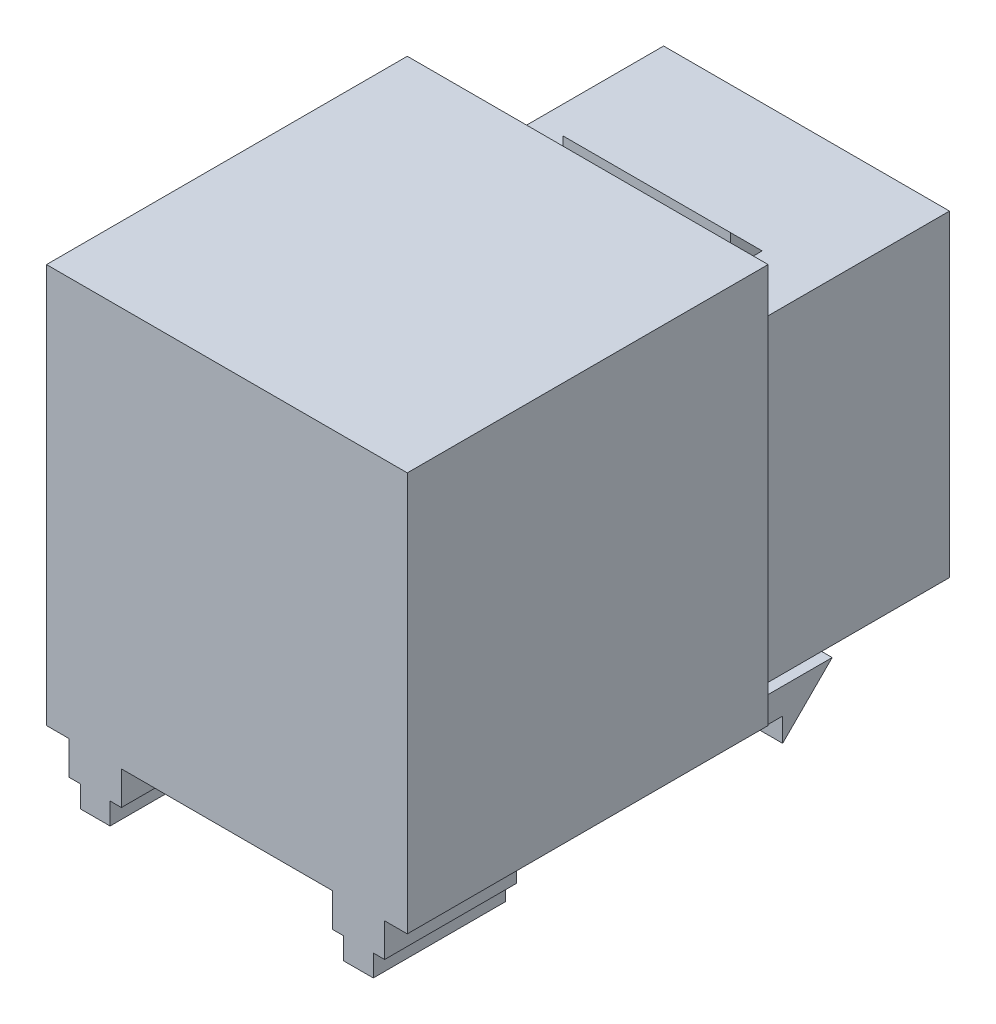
SolidWorks part; units mm, degrees
ref_plane "Front Plane" through (0, 0, 0) normal (0, 0, 1) x (1, 0, 0)
ref_plane "Top Plane" through (0, 0, 0) normal (0, 1, 0) x (1, 0, 0)
ref_plane "Right Plane" through (0, 0, 0) normal (1, 0, 0) x (0, 0, -1)
sketch "Skizze1" plane through (0, 0, 0) normal (0, 0, 1) x (1, 0, 0)
  line L1 (-7.25, -8.05) -> (7.25, -8.05)
  line L2 (-7.25, -8.05) -> (-7.25, 8.05)
  line L3 (-7.25, 8.05) -> (7.25, 8.05)
  line L4 (7.25, -8.05) -> (7.25, 8.05)
  line L5 (-7.25, -8.05) -> (7.25, 8.05) construction
  line L6 (-7.25, 8.05) -> (7.25, -8.05) construction
  point P0 (0, 0)
  dimension "D1" = 14.5
  dimension "D2" = 16.1
extrude "Aufsatz-Linear austragen1" add sketch "Skizze1" along normal blind 11.1
sketch "Skizze2" plane through (0, 0, 11.1) normal (0, 0, 1) x (1, 0, 0)
  line L0 (0, -8.05) -> (0, 11.0554) construction
  line L1 (-7.25, -8.05) -> (7.25, -8.05) construction
  line L2 (-9.15, -8.05) -> (9.15, -8.05)
  line L3 (9.15, -8.05) -> (9.15, 12.2)
  line L4 (9.15, 12.2) -> (-9.15, 12.2)
  line L5 (-9.15, -8.05) -> (-9.15, 12.2)
  point P10 (0, 12.2)
  dimension "D1" = 18.3
  dimension "D2" = 20.25
extrude "Aufsatz-Linear austragen2" add sketch "Skizze2" along normal blind 18.3
ref_plane "Ebene1" through (0, 0, 0) normal (-1, 0, 0) x (0, 0, 1)
sketch "Skizze3" plane through (0, 0, 0) normal (-1, 0, 0) x (0, 0, 1)
  line L0 (8.1, 8.05) -> (8.1, 9.65)
  line L1 (11.1, 8.05) -> (0, 8.05) construction
  line L2 (8.1, 9.65) -> (6.5, 8.05)
  line L3 (6.5, 8.05) -> (8.1, 8.05)
  line L5 (0, 8.05) -> (0, -8.05) construction
  dimension "D1" = 6.5
  dimension "D2" = 45
  dimension "D3" = 1.6
extrude "Aufsatz-Linear austragen3" add sketch "Skizze3" along normal mid plane 8.5
sketch "Skizze4" plane through (0, 0, 0) normal (-1, 0, 0) x (0, 0, 1)
  line L0 (16.8, -8.05) -> (16.8, -11.15)
  line L1 (29.4, -8.05) -> (11.1, -8.05) construction
  line L2 (14.8, -8.05) -> (14.8, -9.8364)
  line L3 (14.8, -9.8364) -> (4.7, -9.8364)
  line L4 (4.7, -9.8364) -> (7.2136, -12.35)
  line L5 (7.2136, -12.35) -> (7.2136, -11.15)
  line L6 (7.2136, -11.15) -> (16.8, -11.15)
  line L7 (0, 8.05) -> (0, -8.05) construction
  line L8 (11.1, -8.05) -> (0, -8.05) construction
  line L9 (14.8, -8.05) -> (16.8, -8.05)
  dimension "D1" = 4.7
  dimension "D2" = 2
  dimension "D3" = 3.1
  dimension "D4" = 12.1
  dimension "D6" = 45
  dimension "D7" = 4.3
extrude "Aufsatz-Linear austragen4" add sketch "Skizze4" along normal mid plane 12
ref_plane "Ebene2" through (0, 0, 22.7) normal (0, 0, 1) x (1, 0, 0)
sketch "Skizze5" plane through (0, 0, 22.7) normal (0, 0, 1) x (1, 0, 0)
  line L0 (-8, -8.05) -> (-8, -9.75)
  line L1 (-9.15, -8.05) -> (9.15, -8.05) construction
  line L2 (-8, -9.75) -> (-7.425, -9.75)
  line L3 (-5.35, -9.75) -> (-5.35, -8.05)
  line L4 (-9.15, 12.2) -> (-9.15, -8.05) construction
  line L5 (-6.675, -9.75) -> (-6.675, -13.56) construction
  line L6 (-5.925, -9.75) -> (-5.925, -10.85)
  line L7 (-5.925, -10.85) -> (-7.425, -10.85)
  line L8 (-7.425, -9.75) -> (-7.425, -10.85)
  line L9 (-5.925, -9.75) -> (-5.35, -9.75)
  line L10 (-8, -8.05) -> (-5.35, -8.05)
  line L11 (0, -8.05) -> (0, -13.9151) construction
  line L12 (6.675, -9.75) -> (6.675, -13.56) construction
  line L13 (8, -8.05) -> (5.35, -8.05)
  line L14 (5.925, -9.75) -> (5.35, -9.75)
  line L15 (7.425, -9.75) -> (7.425, -10.85)
  line L16 (5.925, -10.85) -> (7.425, -10.85)
  line L17 (5.925, -9.75) -> (5.925, -10.85)
  line L18 (5.35, -9.75) -> (5.35, -8.05)
  line L19 (8, -9.75) -> (7.425, -9.75)
  line L20 (8, -8.05) -> (8, -9.75)
  point P14 (-6.675, -10.85)
  point P28 (6.675, -10.85)
  dimension "D1" = 2.65
  dimension "D2" = 3.8
  dimension "D3" = 1.7
  dimension "D4" = 1.5
  dimension "D5" = 2.8
extrude "Aufsatz-Linear austragen5" add sketch "Skizze5" along normal up to surface (6.7 mm away)
